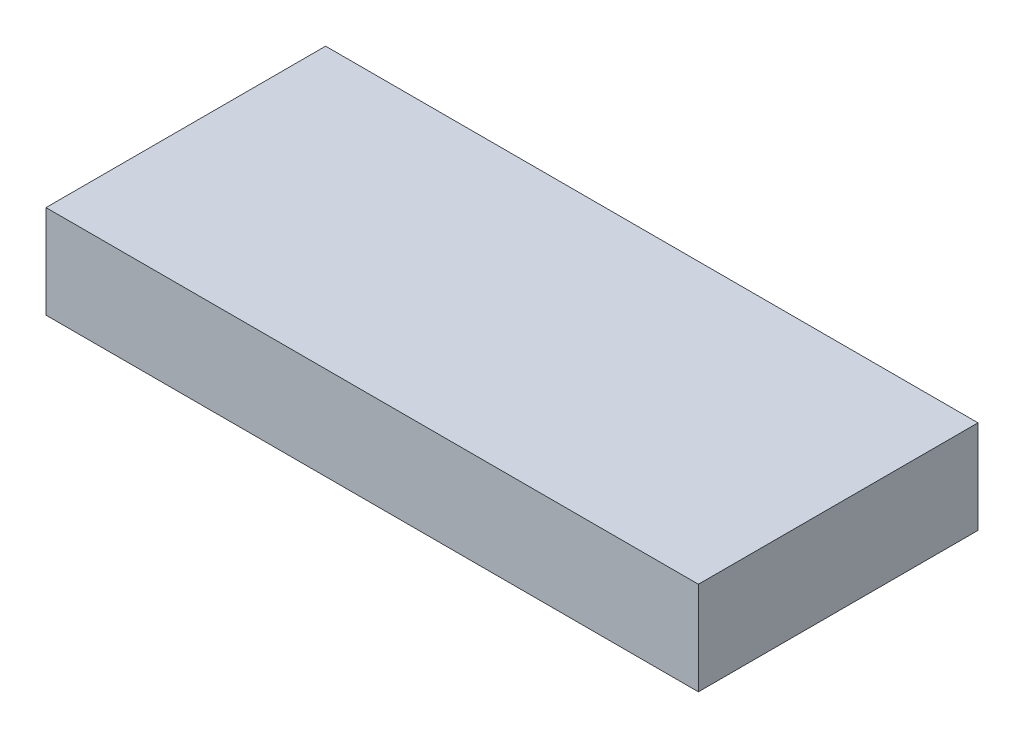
SolidWorks part; units mm, degrees
ref_plane "Plan de face" through (0, 0, 0) normal (0, 0, 1) x (1, 0, 0)
ref_plane "Plan de dessus" through (0, 0, 0) normal (0, 1, 0) x (1, 0, 0)
ref_plane "Plan de droite" through (0, 0, 0) normal (1, 0, 0) x (0, 0, -1)
sketch "Esquisse1" plane through (0, 0, 0) normal (0, 0, 1) x (1, 0, 0)
  line L1 (350, -50) -> (-350, -50)
  line L2 (350, -50) -> (350, 50)
  line L3 (350, 50) -> (-350, 50)
  line L4 (-350, -50) -> (-350, 50)
  line L5 (350, -50) -> (-350, 50) construction
  line L6 (350, 50) -> (-350, -50) construction
  point P0 (0, 0)
  dimension "D1" = 700
  dimension "D2" = 100
extrude "Boss.-Extru.1" add sketch "Esquisse1" along normal mid plane 300
